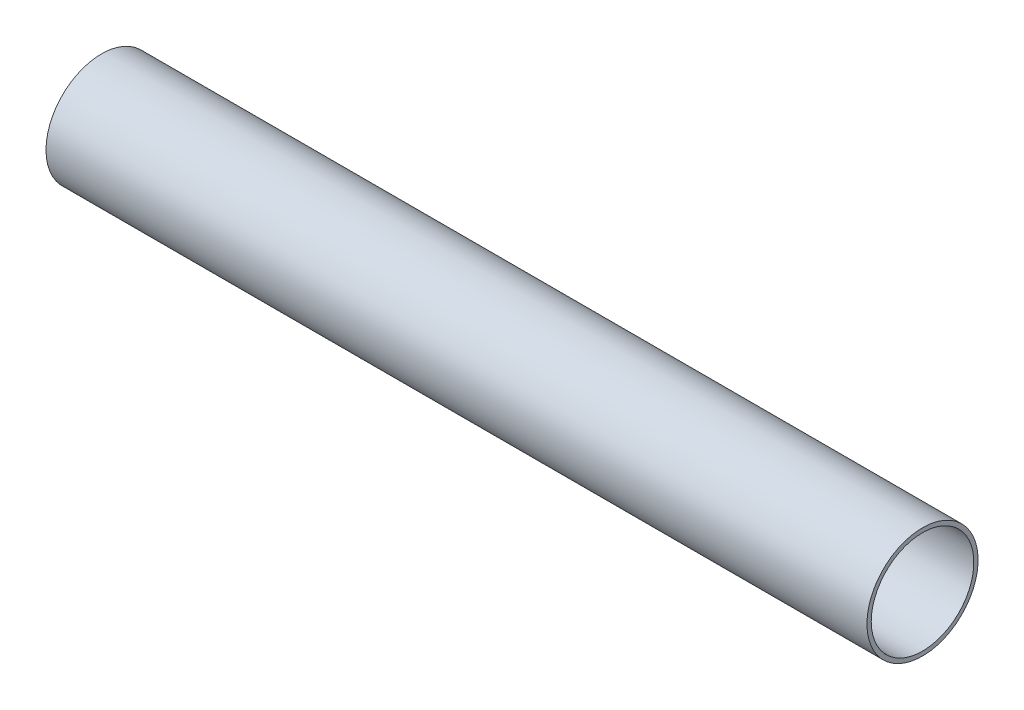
SolidWorks part; units mm, degrees
ref_plane "Front Plane" through (0, 0, 0) normal (0, 0, 1) x (1, 0, 0)
ref_plane "Top Plane" through (0, 0, 0) normal (0, 1, 0) x (1, 0, 0)
ref_plane "Right Plane" through (0, 0, 0) normal (1, 0, 0) x (0, 0, -1)
sketch "Sketch1" plane through (0, 0, 0) normal (1, 0, 0) x (0, 0, -1)
  circle A0 centre (0, 0) radius 20.6375
  circle A1 centre (0, 0) radius 19.05
  dimension "D1" = 41.275
  dimension "D2" = 38.1
extrude "Extrude1" add sketch "Sketch1" along normal blind 304.8
